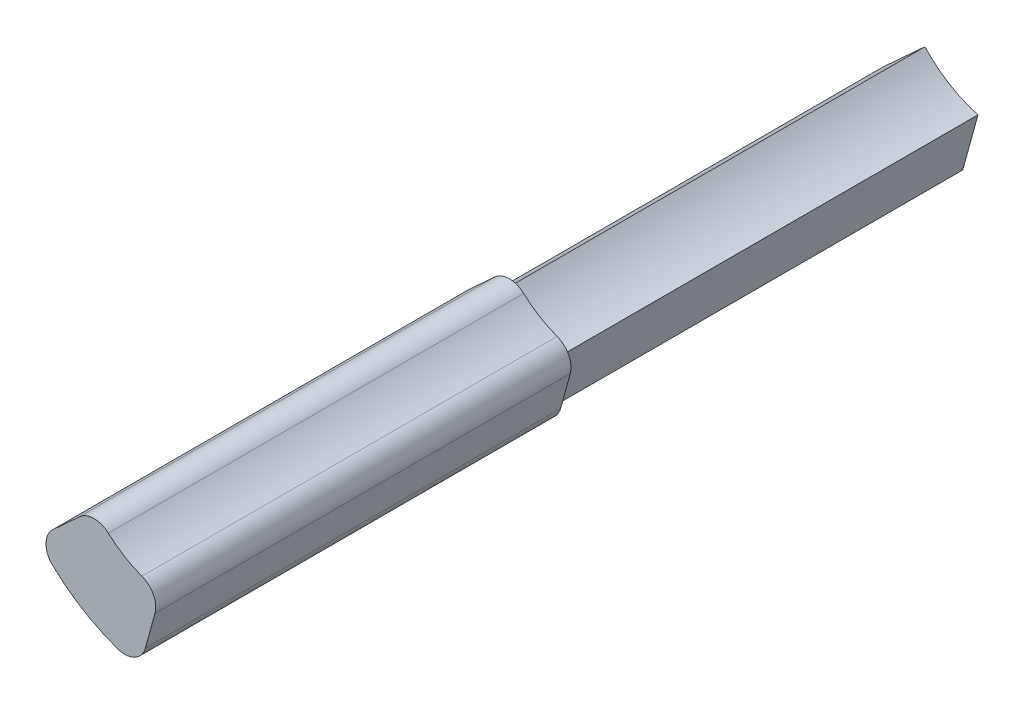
SolidWorks part; units mm, degrees
ref_plane "Plan de face" through (0, 0, 0) normal (0, 0, 1) x (1, 0, 0)
ref_plane "Plan de dessus" through (0, 0, 0) normal (0, 1, 0) x (1, 0, 0)
ref_plane "Plan de droite" through (0, 0, 0) normal (1, 0, 0) x (0, 0, -1)
sketch "Esquisse1" plane through (0, 0, 0) normal (0, 0, 1) x (1, 0, 0)
  line L0 (-3.9015, -3.5872) -> (-5.8891, -5.4147)
  line L1 (-1.4078, -5.1096) -> (-2.1249, -7.7126)
  arc A0 (-5.8891, -5.4147) -> (-2.1249, -7.7126) centre (0, 0) ccw
  arc A1 (-3.9015, -3.5872) -> (-1.4078, -5.1096) centre (0, 0) ccw
  dimension "D1" = 16
  dimension "D2" = 10.6
  dimension "D3" = 32
extrude "Extrusion1" add sketch "Esquisse1" along normal blind 39
sketch "Esquisse2" plane through (0, 0, 39) normal (0, 0, 1) x (1, 0, 0)
  line L6 (-3.8527, -2.8631) -> (-6.5848, -5.375)
  line L7 (-1.7718, -8.3133) -> (-0.786, -4.7352)
  arc A4 (-6.5848, -5.375) -> (-1.7718, -8.3133) centre (0, 0) ccw
  arc A5 (-3.8527, -2.8631) -> (-0.786, -4.7352) centre (0, 0) ccw
extrude "Extrusion2" add sketch "Esquisse2" against normal blind 19.5
fillet "Congé1" radius 1 4 edges at (-6.5848, -5.375, 29.25) (-3.8527, -2.8631, 29.25) (-1.7718, -8.3133, 29.25) (-0.786, -4.7352, 29.25)
